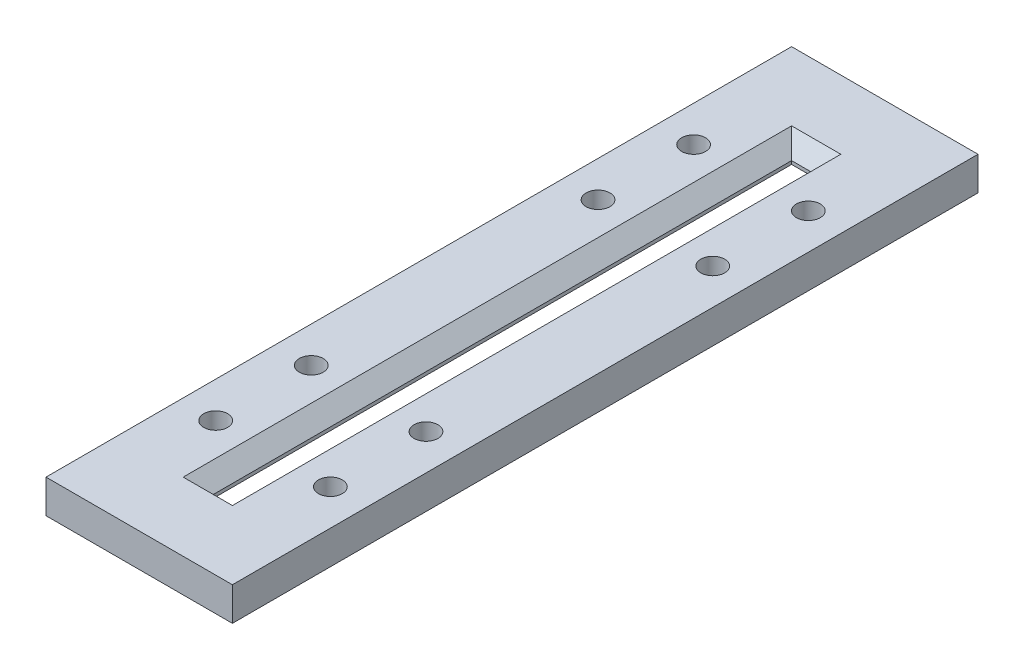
SolidWorks part; units mm, degrees
ref_plane "Front Plane" through (0, 0, 0) normal (1, 0, 0) x (0, 1, 0)
ref_plane "Top Plane" through (0, 0, 0) normal (0, 0, 1) x (0, 1, 0)
ref_plane "Right Plane" through (0, 0, 0) normal (0, 1, 0) x (-1, 0, 0)
sketch "sk 30x0.75in w weld" plane through (0, 0, 0) normal (0, 1, 0) x (-1, 0, 0)
  line L0 (-44.45, 415.925) -> (44.45, 415.925)
  line L1 (-9.525, 381) -> (9.525, 381)
  line L2 (-9.525, 381) -> (-9.525, -381)
  line L3 (-9.525, -381) -> (9.525, -381)
  line L4 (9.525, 381) -> (9.525, -381)
  line L5 (-9.525, 381) -> (9.525, -381) construction
  line L6 (-9.525, -381) -> (9.525, 381) construction
  line L7 (44.45, 415.925) -> (44.45, -415.925)
  line L8 (-44.45, -415.925) -> (44.45, -415.925)
  line L9 (-44.45, 415.925) -> (-44.45, -415.925)
  point P0 (0, 0)
  dimension "D1" = 19.05
  dimension "D2" = 762
  dimension "D3" = 34.925
sketch "sk block" plane through (0, 0, 0) normal (0, 1, 0) x (-1, 0, 0)
  line L8 (-12.7, 384.175) -> (-12.7, -384.175)
  line L9 (-12.7, -384.175) -> (12.7, -384.175)
  line L10 (12.7, -384.175) -> (12.7, 384.175)
  line L11 (12.7, 384.175) -> (-12.7, 384.175)
  line L12 (-12.7, 384.175) -> (-12.7, -384.175)
  line L13 (-12.7, -384.175) -> (12.7, -384.175)
  line L14 (12.7, -384.175) -> (12.7, 384.175)
  line L15 (12.7, 384.175) -> (-12.7, 384.175)
  line L20 (-123.825, 495.3) -> (-123.825, -495.3)
  line L21 (-123.825, -495.3) -> (123.825, -495.3)
  line L22 (123.825, -495.3) -> (123.825, 495.3)
  line L23 (123.825, 495.3) -> (-123.825, 495.3)
  line L24 (-123.825, 495.3) -> (-123.825, -495.3)
  line L25 (-123.825, -495.3) -> (123.825, -495.3)
  line L26 (123.825, -495.3) -> (123.825, 495.3)
  line L27 (123.825, 495.3) -> (-123.825, 495.3)
  dimension "D1" = 3.175
  dimension "D2" = 114.3
sketch "sk Holes" plane through (0, 0, 0) normal (0, 1, 0) x (-1, 0, 0)
  line L0 (-9.525, 381) -> (9.525, 381) construction
  line L1 (-9.525, -381) -> (9.525, -381) construction
  line L2 (-9.525, 381) -> (-9.525, -381) construction
  circle A0 centre (-76.2, 317.5) radius 15.875
  circle A1 centre (76.2, 317.5) radius 15.875
  circle A2 centre (-76.2, -317.5) radius 15.875
  circle A3 centre (76.2, -317.5) radius 15.875
  circle A4 centre (-76.2, 190.5) radius 15.875
  circle A5 centre (76.2, 190.5) radius 15.875
  circle A6 centre (-76.2, -190.5) radius 15.875
  circle A7 centre (76.2, -190.5) radius 15.875
  circle A8 centre (-76.2, 317.5) radius 34.925 construction
  circle A9 centre (76.2, 317.5) radius 34.925 construction
  point P10 (0, 381)
  point P23 (-41.275, 317.5)
  dimension "D1" = 31.75
  dimension "D2" = 31.75
  dimension "D6" = 31.75
  dimension "D7" = 31.75
  dimension "D11" = 69.85
  dimension "D12" = 69.85
  dimension "D13" = 31.75
  dimension "D3" = 63.5
  dimension "D4" = 76.2
  dimension "D5" = 76.2
  dimension "D8" = 63.5
  dimension "D9" = 2
  dimension "D10" = 2
extrude "Boss-Extrude1" add sketch "sk block" along normal blind 44.45
extrude "Cut-Extrude1" cut sketch "sk Holes" along normal through all
chamfer "Chamfer1" distance 20 angle 45 8 edges at (0, 0, 384.175) (-12.7, 0, 0) (0, 0, -384.175) (12.7, 0, 0) (0, 44.45, -384.175) (12.7, 44.45, 0) (0, 44.45, 384.175) (-12.7, 44.45, 0)
